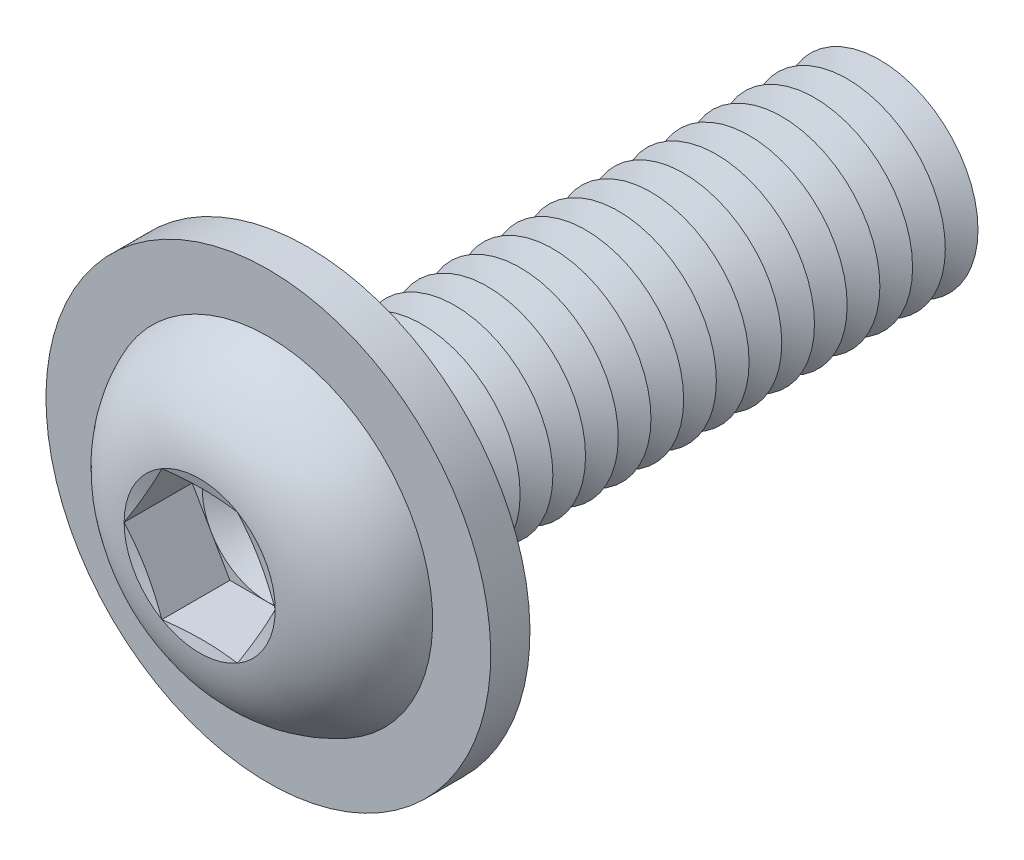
SolidWorks part; units mm, degrees
ref_plane "Front Plane" through (0, 0, 0) normal (0, 0, 1) x (1, 0, 0)
ref_plane "Top Plane" through (0, 0, 0) normal (0, 1, 0) x (1, 0, 0)
ref_plane "Right Plane" through (0, 0, 0) normal (1, 0, 0) x (0, 0, -1)
sketch "Sketch1" plane through (0, 0, 0) normal (1, 0, 0) x (0, 0, -1)
  line L0 (0, 3) -> (0, 5.25)
  line L3 (0, 3) -> (18, 3)
  line L4 (18, 3) -> (18, 0)
  line L5 (18, 0) -> (-3.3, 0) construction
  line L6 (-3.3, 0) -> (18, 0)
  line L7 (-3.3, 2.3094) -> (-3.3, 1.1547) construction
  line L8 (-3.3, 1.1547) -> (-3.3, 0)
  line L9 (-3.3, 2.3094) -> (-2.9906, 1.1547)
  line L10 (-2.9906, 1.1547) -> (-3.3, 1.1547)
  line L11 (18, 0) -> (22.7481, 0) construction
  line L12 (0, 5.25) -> (-3.3, 5.25) construction
  arc A1 (0, 5.25) -> (-3.3, 2.3094) centre (0, 1.928) ccw
  point P8 (18, 1.5)
  dimension "D1" = 10.5
  dimension "D2" = 6
  dimension "D3" = 3.3
  dimension "D4" = 4.6188
  dimension "D5" = 18
  dimension "D6" = 15
revolve "Revolve1" add sketch "Sketch1" angle 360 about L5
fillet "Fillet1" radius 0.5 1 edges at (-3, 0, 0)
sketch "Sketch2" plane through (0, 0, 0) normal (1, 0, 0) x (0, 0, -1)
  line L0 (17.5, 3) -> (18.5, 3)
  line L1 (18, 3) -> (0.5, 3) construction
  line L2 (18.5, 3) -> (18, 2.134)
  line L3 (18, -3) -> (18, 3) construction
  line L4 (18, 2.134) -> (17.5, 3)
  dimension "D1" = 1
revolve "Cut-Revolve1" cut sketch "Sketch2" angle 360 about axis through (0, 0, -18) along (0, 0, -1)
pattern_linear "LPattern1" count 18 spacing 1 along (0, 0, 1) of "Cut-Revolve1"
sketch "Sketch3" plane through (0, 0, 3.3) normal (0, 0, 1) x (1, 0, 0)
  line L7 (1.1547, 2) -> (-1.1547, 2)
  line L8 (-1.1547, 2) -> (-2.3094, 0)
  line L9 (-2.3094, 0) -> (-1.1547, -2)
  line L10 (-1.1547, -2) -> (1.1547, -2)
  line L11 (1.1547, -2) -> (2.3094, 0)
  line L12 (2.3094, 0) -> (1.1547, 2)
  circle A0 centre (0, 0) radius 2 construction
  circle A3 centre (0, 0) radius 2.3094 construction
extrude "Cut-Extrude1" cut sketch "Sketch3" against normal blind 2.08
sketch "Sketch4" plane through (0, 0, 1.22) normal (0, 0, 1) x (1, 0, 0)
  line L1 (1.1547, 2) -> (-1.1547, 2) construction
  circle A0 centre (0, 0) radius 2
extrude "Cut-Extrude2" cut sketch "Sketch4" against normal through all draft 60
sketch "Sketch5" plane through (0, 0, 0) normal (0, 0, -1) x (-1, 0, 0)
  circle A0 centre (0, 0) radius 6.8
  circle A1 centre (0, 0) radius 3.5
  circle A2 centre (0, 0) radius 3.5 construction
  dimension "D1" = 13.6
extrude "Boss-Extrude1" add sketch "Sketch5" against normal blind 1.2
